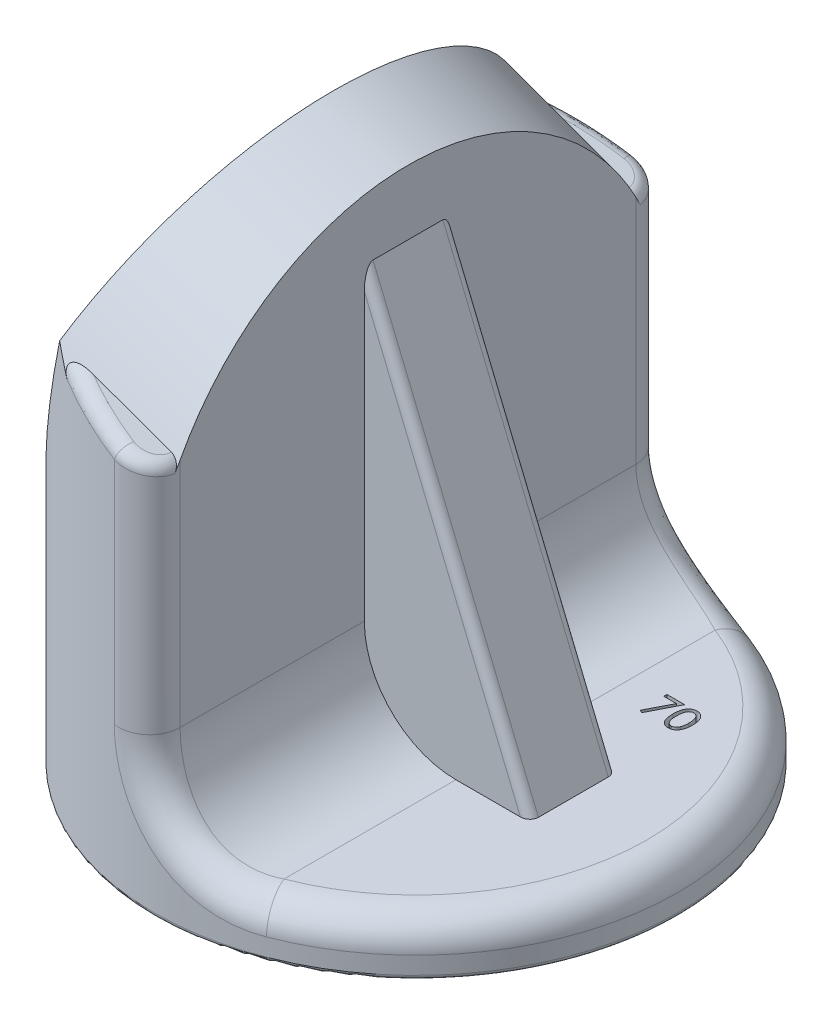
SolidWorks part; units mm, degrees
ref_plane "Front Plane" through (0, 0, 0) normal (0, 0, 1) x (1, 0, 0)
ref_plane "Top Plane" through (0, 0, 0) normal (0, 1, 0) x (1, 0, 0)
ref_plane "Right Plane" through (0, 0, 0) normal (1, 0, 0) x (0, 0, -1)
sketch "Sketch1" plane through (0, 0, 0) normal (0, 1, 0) x (1, 0, 0)
  circle A0 centre (0, 0) radius 30
extrude "Boss-Extrude1" add sketch "Sketch1" along normal blind 80
sketch "Sketch3" plane through (0, 80, 0) normal (0, 1, 0) x (1, 0, 0)
sketch "Sketch4" plane through (0, 0, 0) normal (0, -1, 0) x (-1, 0, 0)
  line L0 (0, 0) -> (-10, 0) construction
  line L1 (0, 0) -> (0, -10) construction
  line L2 (0, 0) -> (0, 10) construction
  line L3 (0, 0) -> (10, 0) construction
  line L5 (-2.5, 2.5) -> (2.5, 2.5)
  line L6 (-2.5, 2.5) -> (-2.5, -2.5)
  line L7 (-2.5, -2.5) -> (2.5, -2.5)
  line L8 (2.5, 2.5) -> (2.5, -2.5)
  line L9 (-2.5, 2.5) -> (2.5, -2.5) construction
  line L10 (-2.5, -2.5) -> (2.5, 2.5) construction
  line L11 (-2.5, -7.5) -> (2.5, -7.5)
  line L12 (-2.5, -7.5) -> (-2.5, -12.5)
  line L13 (-2.5, -12.5) -> (2.5, -12.5)
  line L14 (2.5, -7.5) -> (2.5, -12.5)
  line L15 (-2.5, -7.5) -> (2.5, -12.5) construction
  line L16 (-2.5, -12.5) -> (2.5, -7.5) construction
  line L17 (7.5, 2.5) -> (12.5, 2.5)
  line L18 (7.5, 2.5) -> (7.5, -2.5)
  line L19 (7.5, -2.5) -> (12.5, -2.5)
  line L20 (12.5, 2.5) -> (12.5, -2.5)
  line L21 (7.5, 2.5) -> (12.5, -2.5) construction
  line L22 (7.5, -2.5) -> (12.5, 2.5) construction
  line L23 (-12.5, 2.5) -> (-7.5, 2.5)
  line L24 (-12.5, 2.5) -> (-12.5, -2.5)
  line L25 (-12.5, -2.5) -> (-7.5, -2.5)
  line L26 (-7.5, 2.5) -> (-7.5, -2.5)
  line L27 (-12.5, 2.5) -> (-7.5, -2.5) construction
  line L28 (-12.5, -2.5) -> (-7.5, 2.5) construction
  line L29 (2.5, 7.5) -> (-2.5, 7.5)
  line L30 (2.5, 7.5) -> (2.5, 12.5)
  line L31 (2.5, 12.5) -> (-2.5, 12.5)
  line L32 (-2.5, 7.5) -> (-2.5, 12.5)
  line L33 (2.5, 7.5) -> (-2.5, 12.5) construction
  line L34 (2.5, 12.5) -> (-2.5, 7.5) construction
  dimension "D1" = 5
  dimension "D2" = 5
  dimension "D3" = 5
  dimension "D4" = 5
  dimension "D5" = 5
  dimension "D6" = 5
extrude "Cut-Extrude2" cut sketch "Sketch4" against normal blind 3
fillet "Fillet2" radius 0.5 21 edges at (0, 0, 30) (2.5, 0, 0) (0, 0, 2.5) (-2.5, 0, 0) (0, 0, -2.5) (2.5, 0, 10) (0, 0, 12.5) (-2.5, 0, 10) (0, 0, 7.5) (-7.5, 0, 0) (-10, 0, 2.5) (-12.5, 0, 0) (-10, 0, -2.5) (12.5, 0, 0) (10, 0, 2.5) (7.5, 0, 0) (10, 0, -2.5) (-2.5, 0, -10) (0, 0, -12.5) (2.5, 0, -10) (0, 0, -7.5)
ref_plane "Plane6" through (0, 0, 3.5) normal (0, 0, 1) x (1, 0, 0)
sketch "Sketch13" plane through (0, 0, 3.5) normal (0, 0, 1) x (1, 0, 0)
  line L0 (-30, 6) -> (-3.0662, 80)
  line L1 (-30, 80) -> (-30, 0.5) construction
  line L4 (-3.0662, 80) -> (-30, 80)
  line L5 (-30, 80) -> (-30, 6)
  line L6 (30, 0.5) -> (-30, 0.5) construction
  dimension "D1" = 5.5
  dimension "D2" = 70
extrude "Cut-Extrude10" cut sketch "Sketch13" against normal mid plane 90
ref_plane "Plane4" through (0, 0, -2.5) normal (0, 0, -1) x (-1, 0, 0)
ref_plane "Plane5" through (0, 0, -62.5) normal (0, 0, -1) x (-1, 0, 0)
sketch "Sketch15" plane through (-28.419, 10.3437, 0) normal (-0.9397, 0.342, 0) x (0.342, 0.9397, 0)
  line L0 (-4.6224, 0) -> (0, 0) construction
  line L2 (17.8776, -2.5) -> (12.8776, -2.5)
  line L3 (17.8776, -2.5) -> (17.8776, 2.5)
  line L4 (17.8776, 2.5) -> (12.8776, 2.5)
  line L5 (12.8776, -2.5) -> (12.8776, 2.5)
  line L6 (17.8776, -2.5) -> (12.8776, 2.5) construction
  line L7 (17.8776, 2.5) -> (12.8776, -2.5) construction
  line L8 (27.8776, -2.5) -> (22.8776, -2.5)
  line L9 (27.8776, -2.5) -> (27.8776, 2.5)
  line L10 (27.8776, 2.5) -> (22.8776, 2.5)
  line L11 (22.8776, -2.5) -> (22.8776, 2.5)
  line L12 (27.8776, -2.5) -> (22.8776, 2.5) construction
  line L13 (27.8776, 2.5) -> (22.8776, -2.5) construction
  line L14 (37.8776, -2.5) -> (32.8776, -2.5)
  line L15 (37.8776, -2.5) -> (37.8776, 2.5)
  line L16 (37.8776, 2.5) -> (32.8776, 2.5)
  line L17 (32.8776, -2.5) -> (32.8776, 2.5)
  line L18 (37.8776, -2.5) -> (32.8776, 2.5) construction
  line L19 (37.8776, 2.5) -> (32.8776, -2.5) construction
  line L20 (27.8776, -12.5) -> (22.8776, -12.5)
  line L21 (27.8776, -12.5) -> (27.8776, -7.5)
  line L22 (27.8776, -7.5) -> (22.8776, -7.5)
  line L23 (22.8776, -12.5) -> (22.8776, -7.5)
  line L24 (27.8776, -12.5) -> (22.8776, -7.5) construction
  line L25 (27.8776, -7.5) -> (22.8776, -12.5) construction
  line L26 (27.8776, 7.5) -> (22.8776, 7.5)
  line L27 (27.8776, 7.5) -> (27.8776, 12.5)
  line L28 (27.8776, 12.5) -> (22.8776, 12.5)
  line L29 (22.8776, 7.5) -> (22.8776, 12.5)
  line L30 (27.8776, 7.5) -> (22.8776, 12.5) construction
  line L31 (27.8776, 12.5) -> (22.8776, 7.5) construction
  ellipse E0 centre (83.0917, 0) end of major axis (170.8058, 0) minor radius 30 construction
  point P9 (15.3776, 0)
  point P14 (25.3776, 0)
  point P19 (35.3776, 0)
  point P24 (25.3776, -10)
  point P29 (25.3776, 10)
  dimension "D1" = 40
  dimension "D2" = 30
  dimension "D3" = 20
  dimension "D4" = 5
  dimension "D5" = 5
  dimension "D6" = 5
  dimension "D7" = 5
  dimension "D8" = 5
  dimension "D9" = 5
  dimension "D10" = 5
  dimension "D11" = 5
  dimension "D12" = 10
  dimension "D13" = 10
  dimension "D14" = 5
  dimension "D15" = 5
extrude "Cut-Extrude11" cut sketch "Sketch15" against normal blind 3
ref_plane "Plane7" through (0, 0, 0) normal (0, 0, -1) x (-1, 0, 0)
sketch "Sketch24" plane through (-28.419, 10.3437, 0) normal (-0.9397, 0.342, 0) x (0.342, 0.9397, 0)
  line L0 (25.3776, -30) -> (8.2869, -61.3494)
  line L1 (25.3776, 0) -> (-4.6224, 0)
  line L3 (8.2869, -61.3494) -> (91.449, -58.1784)
  line L4 (91.449, -58.1784) -> (76.5573, 58.2179)
  line L5 (76.5573, 58.2179) -> (25.3776, 46.8115)
  line L6 (25.3776, 46.8115) -> (25.3776, 30)
  arc A0 (25.3776, -30) -> (-4.6224, 0) centre (25.3776, 0) ccw
  ellipse E1 centre (83.0917, 0) end of major axis (170.8058, 0) minor radius 30 construction
  dimension "D1" = 30
extrude "Cut-Extrude13" cut sketch "Sketch24" against normal blind 100 contours A0 M21
fillet "Fillet8" radius 0.5 4 edges at (-19.7394, 34.1908, -7.5) (-18.8843, 36.54, -10) (-19.7394, 34.1908, -12.5) (-20.5944, 31.8415, -10)
fillet "Fillet9" radius 0.5 4 edges at (-16.3192, 43.5877, 2.5) (-15.4641, 45.9369, 0) (-16.3192, 43.5877, -2.5) (-17.1742, 41.2385, 0)
fillet "Fillet10" radius 0.5 4 edges at (-24.0146, 22.4446, 0) (-23.1596, 24.7939, 2.5) (-22.3045, 27.1431, 0) (-23.1596, 24.7939, -2.5)
fillet "Fillet11" radius 0.5 4 edges at (-20.5944, 31.8415, 10) (-19.7394, 34.1908, 12.5) (-18.8843, 36.54, 10) (-19.7394, 34.1908, 7.5)
fillet "Fillet12" radius 0.5 4 edges at (-20.5944, 31.8415, 0) (-19.7394, 34.1908, 2.5) (-18.8843, 36.54, 0) (-19.7394, 34.1908, -2.5)
sketch "Sketch26" plane through (0, 0, 3.5) normal (0, 0, 1) x (1, 0, 0)
  line L1 (21.1305, 54.6487) -> (36.0272, 54.6487)
  line L2 (21.1305, 54.6487) -> (21.1305, 40.5617)
  line L3 (21.1305, 40.5617) -> (36.0272, 40.5617)
  line L4 (36.0272, 54.6487) -> (36.0272, 40.5617)
  line L5 (21.1305, 54.6487) -> (36.0272, 40.5617) construction
  line L6 (21.1305, 40.5617) -> (36.0272, 54.6487) construction
  point P0 (28.5788, 47.6052)
sketch "Sketch27" plane through (-28.419, 10.3437, 0) normal (-0.9397, 0.342, 0) x (0, 0, 1)
  line L0 (26.1468, 40.0863) -> (33.933, 40.0863)
  line L1 (33.933, 40.0863) -> (33.933, 52.9731)
  line L2 (33.933, 52.9731) -> (26.1468, 52.9731)
  line L3 (26.1468, 52.9731) -> (26.1468, 40.0863)
  line L4 (-26.1468, 40.0863) -> (-35.0532, 40.0863)
  line L5 (-35.0532, 40.0863) -> (-35.0532, 54.6027)
  line L6 (-35.0532, 54.6027) -> (-26.1468, 54.6027)
  line L7 (-26.1468, 54.6027) -> (-26.1468, 40.0863)
extrude "Cut-Extrude14" cut sketch "Sketch27" against normal blind 30
sketch "Sketch29" plane through (0, 0, 3.5) normal (0, 0, 1) x (1, 0, 0)
  line L1 (9.0804, 82.4773) -> (38.2479, 82.4773)
  line L2 (9.0804, 82.4773) -> (9.0804, 63.7029)
  line L3 (9.0804, 63.7029) -> (38.2479, 63.7029)
  line L4 (38.2479, 82.4773) -> (38.2479, 63.7029)
extrude "Cut-Extrude15" cut sketch "Sketch29" against normal mid plane 100
sketch "Sketch30" plane through (0, 0, 3.5) normal (0, 0, 1) x (1, 0, 0)
  line L0 (-0.9253, 6) -> (30, 6)
  line L1 (30, 0.5) -> (30, 48.0125) construction
  line L2 (30, 6) -> (30, 48.0125)
  line L3 (30, 48.0125) -> (-0.9253, 59.2684)
  line L4 (30, 48.0125) -> (-9.4788, 62.3816) construction
  line L5 (-0.9253, 59.2684) -> (-0.9253, 6)
extrude "Cut-Extrude16" cut sketch "Sketch30" against normal mid plane 100
fillet "Fillet13" radius 10.5 1 edges at (-0.9253, 6, 0)
fillet "Fillet14" radius 3.5 5 edges at (-0.9253, 29.7479, -29.9857) (1.3741, 9.9425, -29.9685) (3.2239, 8.1383, 29.8263) (-0.9253, 29.7479, 29.9857) (30, 6, 0)
fillet "Fillet15" radius 1.5 4 edges at (-2.1738, 43.4501, -28.8075) (-2.1738, 43.4501, 28.8075)
sketch "Sketch31" plane through (-28.419, 10.3437, 0) normal (-0.9397, 0.342, 0) x (0, 0, 1)
  line L0 (2.8711, 67.7514) -> (38.4659, 42.3207)
  line L1 (38.4659, 42.3207) -> (41.9292, 89.496)
  line L2 (41.9292, 89.496) -> (-40.7219, 85.6618)
  line L3 (-40.7219, 85.6618) -> (-36.081, 45.813)
  line L4 (-36.081, 45.813) -> (2.8711, 67.7514)
extrude "Cut-Extrude17" cut sketch "Sketch31" against normal blind 100
sketch "Sketch33" plane through (0, 0, 0) normal (0, 0, -1) x (-1, 0, 0)
  line L0 (-18.0373, 6) -> (0.9253, 51.85)
  line L1 (-9.5747, 6) -> (-26.5, 6) construction
  line L2 (0.9253, 59.2684) -> (0.9253, 43.0314) construction
  line L3 (0.9253, 51.85) -> (0.9253, 6)
  line L4 (0.9253, 6) -> (-18.0373, 6)
extrude "Boss-Extrude2" add sketch "Sketch33" along normal mid plane 10
fillet "Fillet16" radius 1 2 edges at (8.556, 28.925, -5) (8.556, 28.925, 5)
sketch "Sketch34" plane through (0, 6, 0) normal (0, 1, 0) x (1, 0, 0)
  text T0 "<b>70</b>"
extrude "Cut-Extrude18" cut sketch "Sketch34" against normal blind 2
